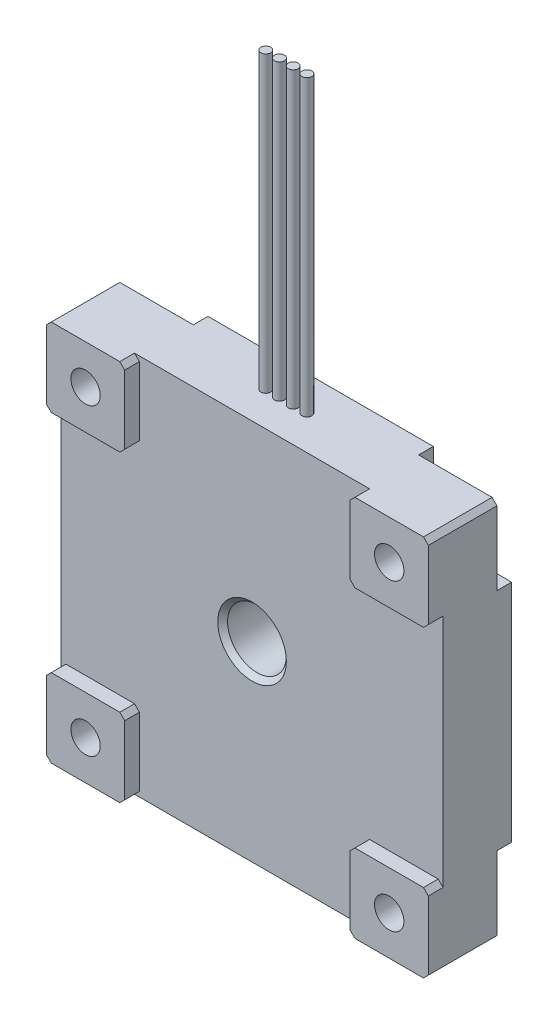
SolidWorks part; units mm, degrees
ref_plane "前视基准面" through (0, 0, 0) normal (0, 0, 1) x (1, 0, 0)
ref_plane "上视基准面" through (0, 0, 0) normal (0, 1, 0) x (1, 0, 0)
ref_plane "右视基准面" through (0, 0, 0) normal (1, 0, 0) x (0, 0, -1)
sketch "草图1" plane through (0, 0, 0) normal (0, 0, 1) x (1, 0, 0)
  line L1 (19.5, -19.5) -> (-19.5, -19.5)
  line L2 (19.5, -19.5) -> (19.5, 19.5)
  line L3 (19.5, 19.5) -> (-19.5, 19.5)
  line L4 (-19.5, -19.5) -> (-19.5, 19.5)
  line L5 (19.5, -19.5) -> (-19.5, 19.5) construction
  line L6 (19.5, 19.5) -> (-19.5, -19.5) construction
  point P0 (0, 0)
  dimension "D1" = 39
  dimension "D2" = 39
extrude "凸台-拉伸1" add sketch "草图1" along normal blind 8.5
sketch "草图2" plane through (0, 0, 8.5) normal (0, 0, 1) x (1, 0, 0)
  line L0 (-15.5, 15.5) -> (15.5, 15.5) construction
  line L1 (19.5, -19.5) -> (-19.5, -19.5)
  line L2 (19.5, -19.5) -> (19.5, 19.5)
  line L3 (19.5, 19.5) -> (-19.5, 19.5)
  line L4 (-19.5, -19.5) -> (-19.5, 19.5)
  line L5 (19.5, -19.5) -> (-19.5, 19.5) construction
  line L6 (19.5, 19.5) -> (-19.5, -19.5) construction
  line L7 (-21.7135, 0) -> (22.1786, 0) construction
  line L8 (0, -21.7323) -> (0, 23.5418) construction
  circle A0 centre (-15.5, 15.5) radius 1.5
  circle A1 centre (15.5, 15.5) radius 1.5
  circle A2 centre (15.5, -15.5) radius 1.5
  circle A3 centre (-15.5, -15.5) radius 1.5
  point P0 (0, 0)
  dimension "D2" = 3
  dimension "D1" = 31
extrude "切除-拉伸1" cut sketch "草图2" against normal through all flip side to cut
sketch "草图3" plane through (0, 0, 8.5) normal (0, 0, 1) x (1, 0, 0)
  line L0 (-11.5, 11.5) -> (-19.5, 11.5)
  line L1 (19.5, 19.5) -> (-19.5, -19.5) construction
  line L2 (-25.8175, 0) -> (26.3718, 0) construction
  line L3 (0, -21.9765) -> (0, 23.9958) construction
  line L4 (-19.5, 19.5) -> (-19.5, -19.5)
  line L5 (-19.5, -19.5) -> (19.5, -19.5)
  line L6 (19.5, -19.5) -> (19.5, 19.5)
  line L7 (19.5, 19.5) -> (-19.5, 19.5)
  line L8 (-19.5, 19.5) -> (-19.5, -19.5)
  line L9 (-19.5, -19.5) -> (19.5, -19.5)
  line L10 (19.5, -19.5) -> (19.5, 19.5)
  line L11 (19.5, 19.5) -> (-19.5, 19.5)
  line L12 (-11.5, 11.5) -> (-11.5, 19.5)
  line L13 (11.5, 11.5) -> (19.5, 11.5)
  line L14 (11.5, 11.5) -> (11.5, 19.5)
  line L15 (-19.5, 19.5) -> (-11.5, 11.5) construction
  line L16 (11.5, -11.5) -> (19.5, -11.5)
  line L17 (11.5, -11.5) -> (11.5, -19.5)
  line L18 (-11.5, -11.5) -> (-19.5, -11.5)
  line L19 (-11.5, -11.5) -> (-11.5, -19.5)
  circle A1 centre (-15.5, 15.5) radius 1.6 construction
  dimension "D2" = 3.2
  dimension "D1" = 0
extrude "切除-拉伸16" cut sketch "草图3" against normal blind 1.5
sketch "草图4" plane through (0, 0, 0) normal (0, 0, -1) x (-1, 0, 0)
  line L0 (-15.5, 15.5) -> (-15.5, 11.5) construction
  line L1 (19.5, -19.5) -> (-19.5, -19.5)
  line L2 (19.5, -19.5) -> (19.5, 19.5)
  line L3 (19.5, 19.5) -> (-19.5, 19.5)
  line L4 (-19.5, -19.5) -> (-19.5, 19.5)
  line L5 (19.5, -19.5) -> (-19.5, 19.5) construction
  line L6 (19.5, 19.5) -> (-19.5, -19.5) construction
  line L7 (-23.216, 0) -> (25.6705, 0) construction
  line L8 (0, -23.9118) -> (0, 24.8656) construction
  line L9 (11.5, 11.5) -> (19.5, 11.5)
  line L10 (11.5, 19.5) -> (11.5, 11.5)
  line L11 (11.5, -11.5) -> (19.5, -11.5)
  line L12 (-11.5, 19.5) -> (-11.5, 11.5)
  line L13 (-11.5, 11.5) -> (-19.5, 11.5)
  line L14 (11.5, -19.5) -> (11.5, -11.5)
  line L15 (-11.5, -11.5) -> (-19.5, -11.5)
  line L16 (-11.5, -19.5) -> (-11.5, -11.5)
  circle A0 centre (-15.5, 15.5) radius 2 construction
  point P3 (0, 0)
  dimension "D1" = 4
extrude "切除-拉伸17" cut sketch "草图4" against normal blind 1.5
chamfer "倒角3" distance 0.5 angle 45 4 edges at (-19.5, -19.5, 5) (19.5, -19.5, 5) (19.5, 19.5, 5) (-19.5, 19.5, 5)
sketch "草图5" plane through (0, 0, 0) normal (0, 0, 1) x (1, 0, 0)
  circle A0 centre (0, 0) radius 2.5
  dimension "D1" = 5
extrude "切除-拉伸20" cut sketch "草图5" along normal through all contours A0
chamfer "倒角4" distance 0.5 angle 45 12 edges at (11.5, -19.5, 7.75) (11.5, -11.5, 7.75) (19.5, -11.5, 7.75) (-19.5, -11.5, 7.75) (-11.5, -11.5, 7.75) (-11.5, -19.5, 7.75) (19.5, 11.5, 7.75) (11.5, 11.5, 7.75) (11.5, 19.5, 7.75) (-11.5, 19.5, 7.75) (-19.5, 11.5, 7.75) (-11.5, 11.5, 7.75)
sketch "草图6" plane through (0, 0, 0) normal (0, 0, -1) x (-1, 0, 0)
  circle A0 centre (0, 0) radius 3
  dimension "D1" = 6
extrude "切除-拉伸21" cut sketch "草图6" against normal through all
chamfer "倒角5" distance 0.5 angle 45 2 edges at (3, 0, 7) (-3, 0, 0)
sketch "草图7" plane through (0, 19.5, 0) normal (0, 1, 0) x (1, 0, 0)
  line L0 (0, 0) -> (0, -7) construction
  line L1 (0, -3.5) -> (-22.6886, -3.5) construction
  line L2 (0, -3.5) -> (25.5169, -3.5) construction
  line L3 (12, -7) -> (-12, -7) construction
  circle A0 centre (-2.1, -3.5) radius 0.5
  circle A1 centre (-0.7, -3.5) radius 0.5
  circle A2 centre (0.7, -3.5) radius 0.5
  circle A3 centre (2.1, -3.5) radius 0.5
  dimension "D1" = 1
  dimension "D2" = 2.1
  dimension "D3" = 4
extrude "凸台-拉伸2" add sketch "草图7" along normal blind 30
